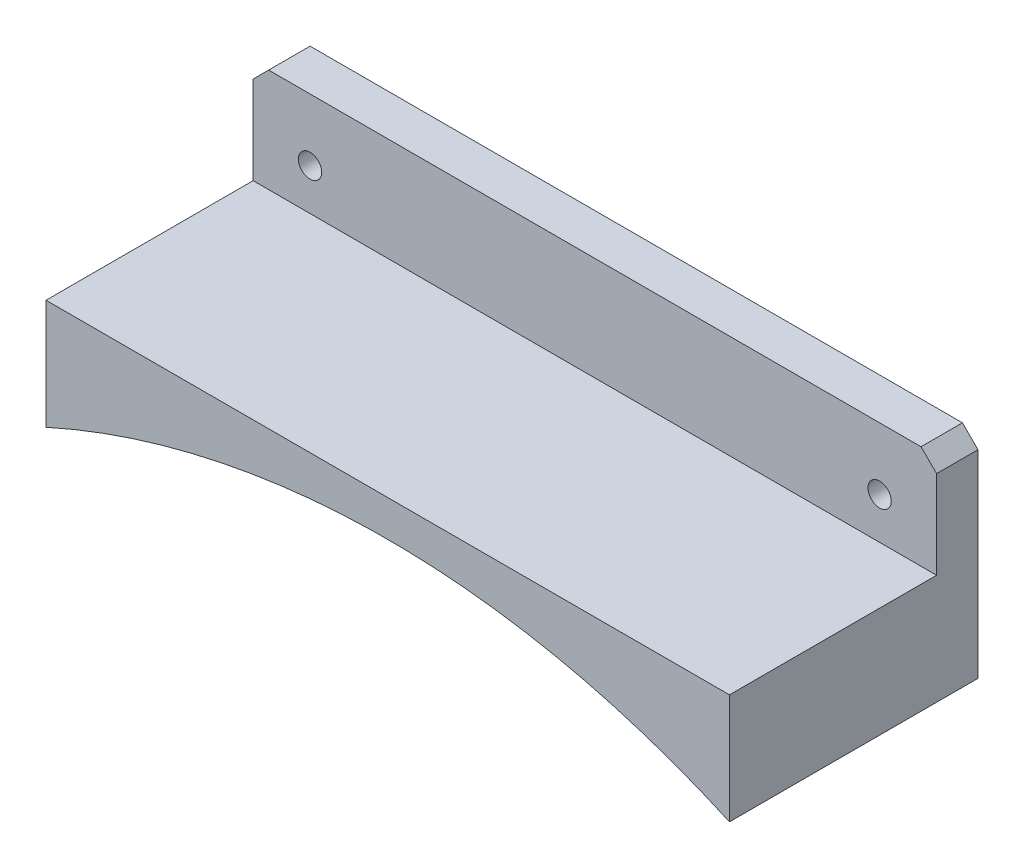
SolidWorks part; units mm, degrees
ref_plane "前视基准面" through (0, 0, 0) normal (0, 0, 1) x (1, 0, 0)
ref_plane "上视基准面" through (0, 0, 0) normal (0, 1, 0) x (1, 0, 0)
ref_plane "右视基准面" through (0, 0, 0) normal (1, 0, 0) x (0, 0, -1)
other "Configuration Table"
sketch "草图1" plane through (0, 0, 0) normal (0, 0, 1) x (1, 0, 0)
  line L0 (-66, 17) -> (-63, 20)
  line L1 (-63, 20) -> (63, 20)
  line L2 (63, 20) -> (66, 17)
  line L3 (66, 17) -> (66, -21.2468)
  line L4 (-66, -21.2468) -> (-66, 17)
  arc A0 (66, -21.2468) -> (-66, -21.2468) centre (0, -167) ccw
  circle A1 centre (-55, 8) radius 2.25
  circle A2 centre (55, 8) radius 2.25
  dimension "D1" = 4.5
  dimension "D2" = 160
  dimension "D3" = 55
  dimension "D4" = 63
  dimension "D5" = 66
  dimension "D6" = 55
  dimension "D7" = 8
  dimension "D8" = 17
  dimension "D9" = 20
  dimension "D10" = 21.2468
extrude "Back_flange_M4_pitch110" add sketch "草图1" along normal blind 8
sketch "草图2" plane through (0, 0, 0) normal (0, 0, 1) x (1, 0, 0)
  line L0 (-66, 0) -> (66, 0)
  line L1 (66, 0) -> (66, -21.2468)
  line L2 (-66, -21.2468) -> (-66, 0)
  arc A0 (66, -21.2468) -> (-66, -21.2468) centre (0, -167) ccw
  dimension "D1" = 160
  dimension "D2" = 66
  dimension "D3" = 21.2468
extrude "Saddle_R160_depth40" add sketch "草图2" along normal blind 40 from offset 8
